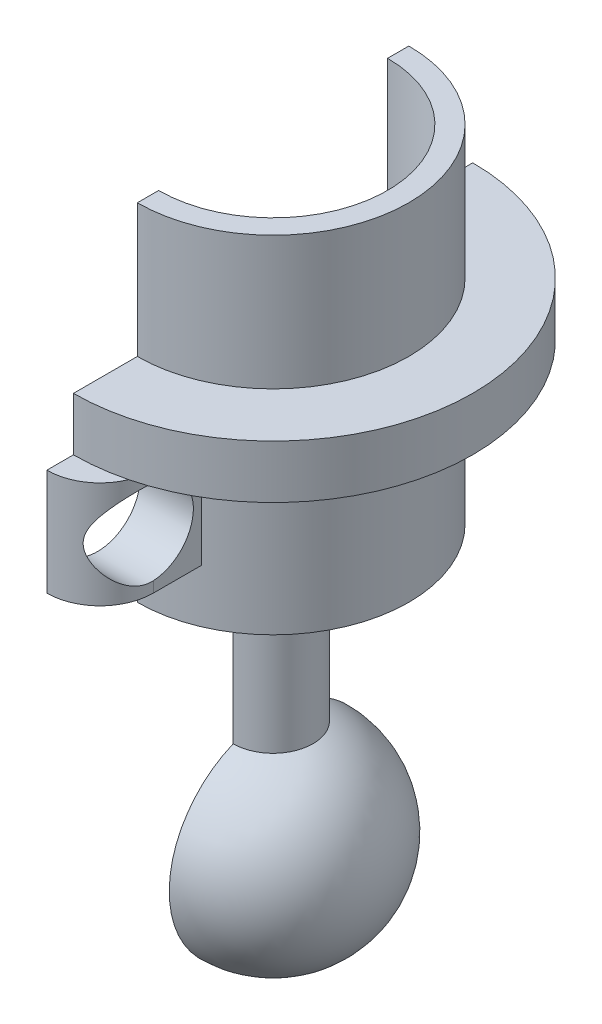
SolidWorks part; units mm, degrees
ref_plane "Front Plane" through (0, 0, 0) normal (0, 0, 1) x (1, 0, 0)
ref_plane "Top Plane" through (0, 0, 0) normal (0, 1, 0) x (1, 0, 0)
ref_plane "Right Plane" through (0, 0, 0) normal (1, 0, 0) x (0, 0, -1)
body saved out of another part "Stock-roll_damper_chamber_outer3-1"
